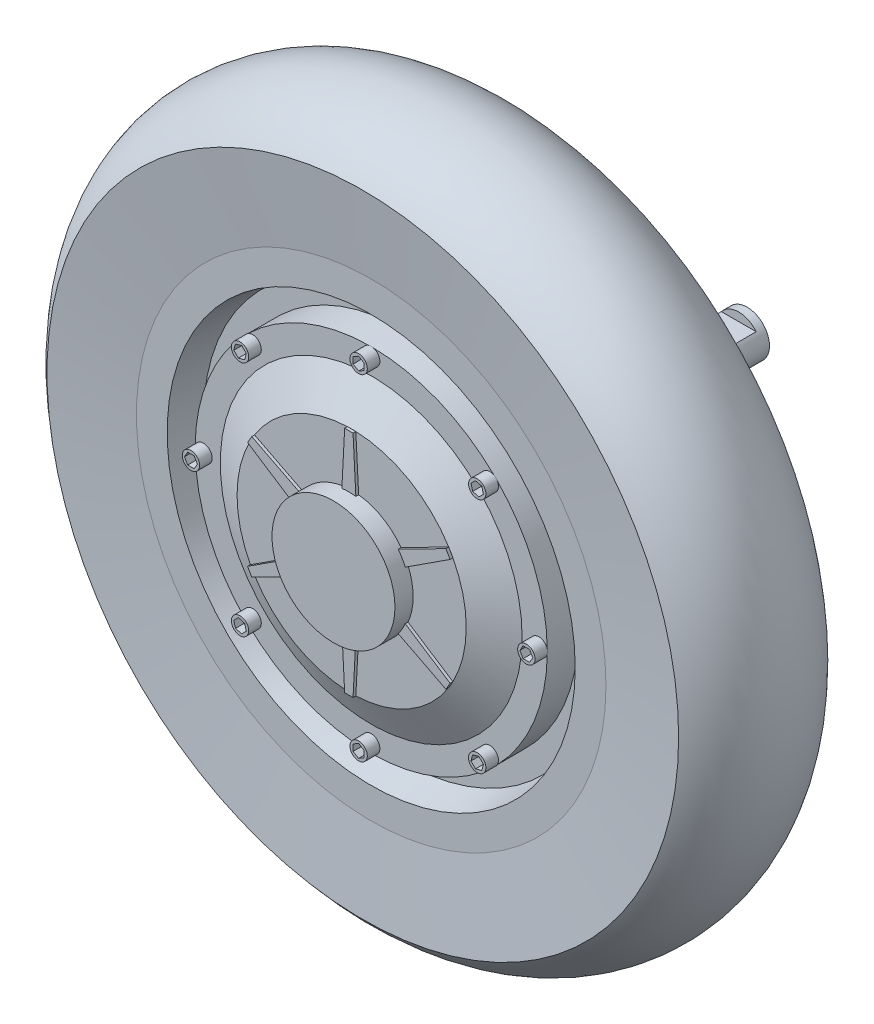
SolidWorks part; units mm, degrees
ref_plane "Plan de face" through (0, 0, 0) normal (0, 0, 1) x (1, 0, 0)
ref_plane "Plan de dessus" through (0, 0, 0) normal (0, 1, 0) x (1, 0, 0)
ref_plane "Plan de droite" through (0, 0, 0) normal (1, 0, 0) x (0, 0, -1)
sketch "Esquisse1" plane through (0, 0, 0) normal (1, 0, 0) x (0, 0, -1)
  line L0 (0, 0) -> (94.3341, 0) construction
  line L1 (87.5, 0) -> (-47, 0)
  line L2 (-47, 0) -> (-47, 63) construction
  line L3 (-47, 63) -> (-36, 63)
  line L4 (-36, 63) -> (-36, 71)
  line L5 (-36, 71) -> (-47, 73)
  line L6 (-47, 73) -> (-50, 113) construction
  line L7 (-23.5, 126) -> (-23.5, 0) construction
  line L8 (0, 0) -> (0, 63) construction
  line L9 (0, 63) -> (-11, 63)
  line L10 (-11, 63) -> (-11, 71)
  line L11 (-11, 71) -> (0, 73)
  line L12 (0, 73) -> (3, 113) construction
  line L13 (13.5, 8) -> (87.5, 8)
  line L14 (87.5, 8) -> (87.5, 0)
  line L15 (0, 63) -> (0, 8.5) construction
  line L16 (-50, 113) -> (-47, 84)
  line L17 (-47, 84) -> (-47, 73)
  line L18 (0, 73) -> (0, 84)
  line L19 (0, 84) -> (3, 113)
  line L20 (-47, 63) -> (-47, 54)
  line L21 (-47, 54) -> (-54, 41)
  line L22 (-54, 41) -> (-54, 22)
  line L23 (-54, 22) -> (-60.5, 22)
  line L24 (-60.5, 22) -> (-60.5, 0)
  line L25 (-60.5, 0) -> (-47, 0)
  line L26 (0, 63) -> (0, 54)
  line L27 (0, 54) -> (7, 41)
  line L28 (7, 41) -> (7, 22)
  line L29 (7, 22) -> (13.5, 22)
  line L30 (13.5, 22) -> (13.5, 8)
  arc A0 (-50, 113) -> (3, 113) centre (-23.5, 92.4904) cw
  dimension "D3" = 53
  dimension "D1" = 113
  dimension "D2" = 40
  dimension "D4" = 23.5
  dimension "D5" = 11
  dimension "D6" = 8
  dimension "D7" = 10
  dimension "D8" = 252
  dimension "D9" = 16
  dimension "D10" = 74
  dimension "D11" = 11
  dimension "D12" = 44
  dimension "D13" = 19
  dimension "D14" = 13
  dimension "D15" = 7
  dimension "D16" = 6.5
revolve "Révolution1" add sketch "Esquisse1" angle 360 about L0
sketch "Esquisse2" plane through (0, 0, -87.5) normal (0, 0, -1) x (-1, 0, 0)
  line L0 (-6.245, 5) -> (6.245, 5)
  line L1 (-6.245, 5) -> (-6.245, 8)
  line L2 (6.245, 5) -> (6.245, 8)
  line L3 (-6.245, 8) -> (6.245, 8)
  line L4 (0, 5) -> (0, -8) construction
  circle A1 centre (0, 0) radius 8 construction
  dimension "D1" = 13
extrude "Enlèv. mat.-Extru.1" cut sketch "Esquisse2" against normal blind 44 from offset 3
sketch "Esquisse3" plane through (0, 0, 0) normal (0, 1, 0) x (1, 0, 0)
  line L0 (0, 0) -> (0, 37.0543) construction
  line L1 (0, 34.5) -> (-8.5, 34.5)
  line L2 (0, 34.5) -> (0, 13.5)
  line L3 (-8.5, 34.5) -> (-8.5, 13.5)
  line L4 (0, 13.5) -> (-8.5, 13.5)
  line L5 (22, 13.5) -> (-22, 13.5) construction
  dimension "D1" = 17
  dimension "D2" = 21
revolve "Révolution2" add sketch "Esquisse3" angle 360 about L0
sketch "Esquisse4" plane through (0, 0, 54) normal (0, 0, 1) x (1, 0, 0)
  line L0 (0, 0) -> (0, 41) construction
  line L1 (-1.5, 40.9726) -> (1.5, 40.9726)
  line L2 (1.5, 40.9726) -> (2.5, 21.8575)
  line L3 (2.5, 21.8575) -> (-2.5, 21.8575)
  line L4 (-2.5, 21.8575) -> (-1.5, 40.9726)
  circle A0 centre (0, 0) radius 41 construction
  circle A1 centre (0, 0) radius 22 construction
  point P13 (0, 40.9726)
  point P14 (0, 21.8575)
  dimension "D1" = 3
  dimension "D2" = 5
extrude "Boss.-Extru.1" add sketch "Esquisse4" along normal blind 1 and the other way offset from surface (62 mm away) 1
pattern_circular "Répétition circulaire1" count 6 over 360 about axis through (0, 0, 0) along (0, 0, 1) of "Boss.-Extru.1"
sketch "Esquisse5" plane through (0, 0, 47) normal (0, 0, 1) x (1, 0, 0)
  circle A0 centre (0, 60) radius 3.1
  dimension "D2" = 6.2
  dimension "D1" = 60
extrude "Boss.-Extru.2" add sketch "Esquisse5" along normal blind 4.5
sketch "Esquisse6" plane through (0, 0, 51.5) normal (0, 0, 1) x (1, 0, 0)
  line L1 (2, 58.8453) -> (2, 61.1547)
  line L2 (2, 61.1547) -> (0, 62.3094)
  line L3 (0, 62.3094) -> (-2, 61.1547)
  line L4 (-2, 61.1547) -> (-2, 58.8453)
  line L5 (-2, 58.8453) -> (0, 57.6906)
  line L6 (0, 57.6906) -> (2, 58.8453)
  circle A0 centre (0, 60) radius 2 construction
  dimension "D1" = 4
extrude "Enlèv. mat.-Extru.2" cut sketch "Esquisse6" against normal blind 3
pattern_circular "Répétition circulaire2" count 8 over 360 about axis through (0, 0, 0) along (0, 0, 1) of "Enlèv. mat.-Extru.2", "Boss.-Extru.2"
